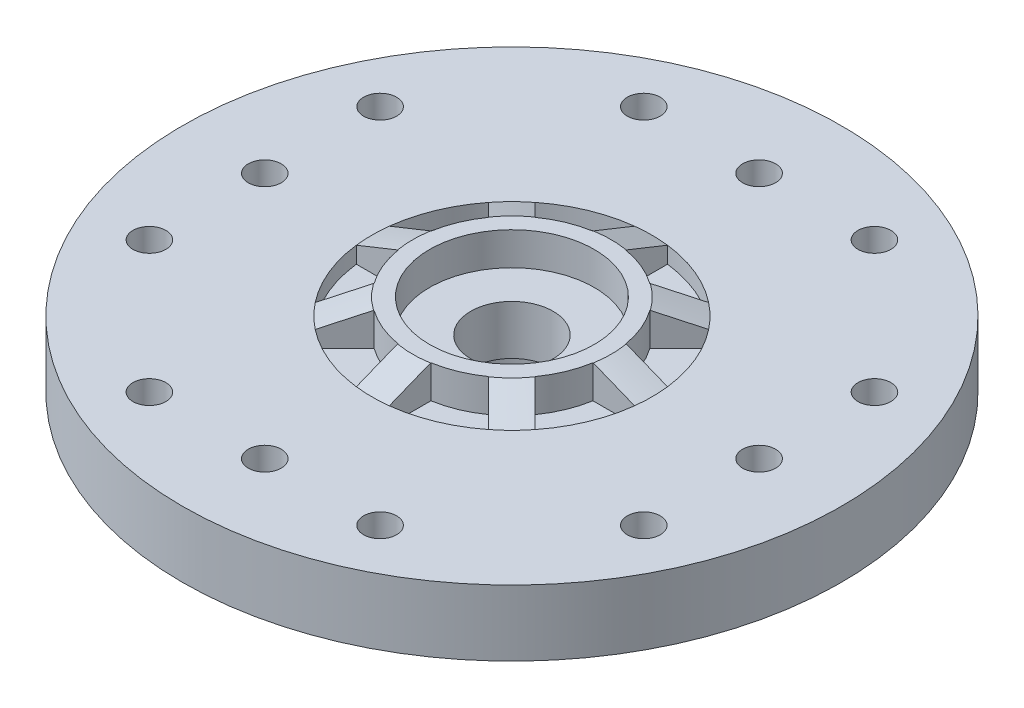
SolidWorks part; units mm, degrees
ref_plane "Front Plane" through (0, 0, 0) normal (0, 0, 1) x (1, 0, 0)
ref_plane "Top Plane" through (0, 0, 0) normal (0, 1, 0) x (1, 0, 0)
ref_plane "Right Plane" through (0, 0, 0) normal (1, 0, 0) x (0, 0, -1)
sketch "Sketch1" plane through (0, 0, 0) normal (0, 1, 0) x (1, 0, 0)
  circle A0 centre (0, 0) radius 10
  circle A1 centre (0, 0) radius 1.25
  dimension "D1" = 20
  dimension "D2" = 2.5
extrude "Boss-Extrude1" add sketch "Sketch1" along normal blind 2
sketch "Sketch2" plane through (0, 0, 0) normal (0, -1, 0) x (1, 0, 0)
  circle A1 centre (0, 0) radius 4.25
  circle A2 centre (0, 0) radius 2.25
  dimension "D1" = 8.5
  dimension "D2" = 4.5
extrude "Boss-Extrude2" add sketch "Sketch2" along normal blind 3
sketch "Sketch4" plane through (0, 2, 0) normal (0, 1, 0) x (1, 0, 0)
  circle A0 centre (0, 0) radius 1.25 construction
  circle A1 centre (0, 0) radius 1.25
  circle A2 centre (0, 0) radius 4.25
  dimension "D1" = 8.5
extrude "Cut-Extrude1" cut sketch "Sketch4" against normal blind 0.5
sketch "Sketch5" plane through (0, 1.5, 0) normal (0, 1, 0) x (1, 0, 0)
  line L0 (0, 0) -> (0, 4.25) construction
  line L1 (-0.5, 2.958) -> (-0.5, 4.2205)
  line L2 (0.5, 2.958) -> (0.5, 4.2205)
  line L3 (1.7381, 2.4452) -> (2.6308, 3.3379)
  line L4 (2.4452, 1.7381) -> (3.3379, 2.6308)
  line L5 (0, 0) -> (3.0052, 3.0052) construction
  line L6 (2.958, 0.5) -> (4.2205, 0.5)
  line L7 (2.958, -0.5) -> (4.2205, -0.5)
  line L8 (0, 0) -> (4.25, 0) construction
  line L9 (2.4452, -1.7381) -> (3.3379, -2.6308)
  line L10 (1.7381, -2.4452) -> (2.6308, -3.3379)
  line L11 (0, 0) -> (3.0052, -3.0052) construction
  line L12 (0.5, -2.958) -> (0.5, -4.2205)
  line L13 (-0.5, -2.958) -> (-0.5, -4.2205)
  line L14 (0, 0) -> (0, -4.25) construction
  line L15 (-1.7381, -2.4452) -> (-2.6308, -3.3379)
  line L16 (-2.4452, -1.7381) -> (-3.3379, -2.6308)
  line L17 (0, 0) -> (-3.0052, -3.0052) construction
  line L18 (-2.958, -0.5) -> (-4.2205, -0.5)
  line L19 (-2.958, 0.5) -> (-4.2205, 0.5)
  line L20 (0, 0) -> (-4.25, 0) construction
  line L21 (-2.4452, 1.7381) -> (-3.3379, 2.6308)
  line L22 (-1.7381, 2.4452) -> (-2.6308, 3.3379)
  line L23 (0, 0) -> (-3.0052, 3.0052) construction
  circle A1 centre (0, 0) radius 2.5
  arc A2 (-0.5, 2.958) -> (-1.7381, 2.4452) centre (0, 0) ccw
  circle A3 centre (0, 0) radius 4.25 construction
  arc A4 (-2.6308, 3.3379) -> (-3.3379, 2.6308) centre (0, 0) ccw
  arc A5 (-4.2205, 0.5) -> (-4.2205, -0.5) centre (0, 0) ccw
  arc A6 (-3.3379, -2.6308) -> (-2.6308, -3.3379) centre (0, 0) ccw
  arc A7 (-0.5, -4.2205) -> (0.5, -4.2205) centre (0, 0) ccw
  arc A8 (2.6308, -3.3379) -> (3.3379, -2.6308) centre (0, 0) ccw
  arc A9 (4.2205, -0.5) -> (4.2205, 0.5) centre (0, 0) ccw
  arc A10 (3.3379, 2.6308) -> (2.6308, 3.3379) centre (0, 0) ccw
  arc A11 (0.5, 4.2205) -> (-0.5, 4.2205) centre (0, 0) ccw
  arc A12 (-2.4452, 1.7381) -> (-2.958, 0.5) centre (0, 0) ccw
  arc A13 (-2.958, -0.5) -> (-2.4452, -1.7381) centre (0, 0) ccw
  arc A14 (1.7381, 2.4452) -> (0.5, 2.958) centre (0, 0) ccw
  arc A15 (2.958, 0.5) -> (2.4452, 1.7381) centre (0, 0) ccw
  arc A16 (2.4452, -1.7381) -> (2.958, -0.5) centre (0, 0) ccw
  arc A17 (0.5, -2.958) -> (1.7381, -2.4452) centre (0, 0) ccw
  arc A18 (-1.7381, -2.4452) -> (-0.5, -2.958) centre (0, 0) ccw
  point P48 (0, 0)
  dimension "D1" = 1
  dimension "D2" = 5
  dimension "D3" = 6
  dimension "D4" = 8
extrude "Boss-Extrude3" add sketch "Sketch5" along normal blind 1
chamfer "Chamfer1" distance 0.5 angle 68 8 edges at (-3.0052, 2.5, -3.0052) (-4.25, 2.5, 0) (-3.0052, 2.5, 3.0052) (0, 2.5, 4.25) (3.0052, 2.5, 3.0052) (4.25, 2.5, 0) (3.0052, 2.5, -3.0052) (0, 2.5, -4.25)
sketch "Sketch9" plane through (0, 2, 0) normal (0, 1, 0) x (1, 0, 0)
  line L0 (0, 0) -> (0, 7.5) construction
  line L1 (3.5, 7.5) -> (-3.5, 7.5) construction
  circle A0 centre (0, 7.5) radius 0.5
  circle A1 centre (-3.5, 7.5) radius 0.5
  circle A2 centre (3.5, 7.5) radius 0.5
  circle A3 centre (7.5, 0) radius 0.5
  circle A4 centre (7.5, 3.5) radius 0.5
  circle A5 centre (7.5, -3.5) radius 0.5
  circle A6 centre (0, -7.5) radius 0.5
  circle A7 centre (3.5, -7.5) radius 0.5
  circle A8 centre (-3.5, -7.5) radius 0.5
  circle A9 centre (-7.5, 0) radius 0.5
  circle A10 centre (-7.5, -3.5) radius 0.5
  circle A11 centre (-7.5, 3.5) radius 0.5
  point P6 (0, 7.5)
  point P16 (7.5, 0)
  point P23 (0, -7.5)
  point P30 (-7.5, 0)
  point P33 (0, 0)
  dimension "D3" = 1
  dimension "D1" = 7
  dimension "D2" = 7.5
  dimension "D4" = 4
extrude "Cut-Extrude2" cut sketch "Sketch9" against normal up to next
